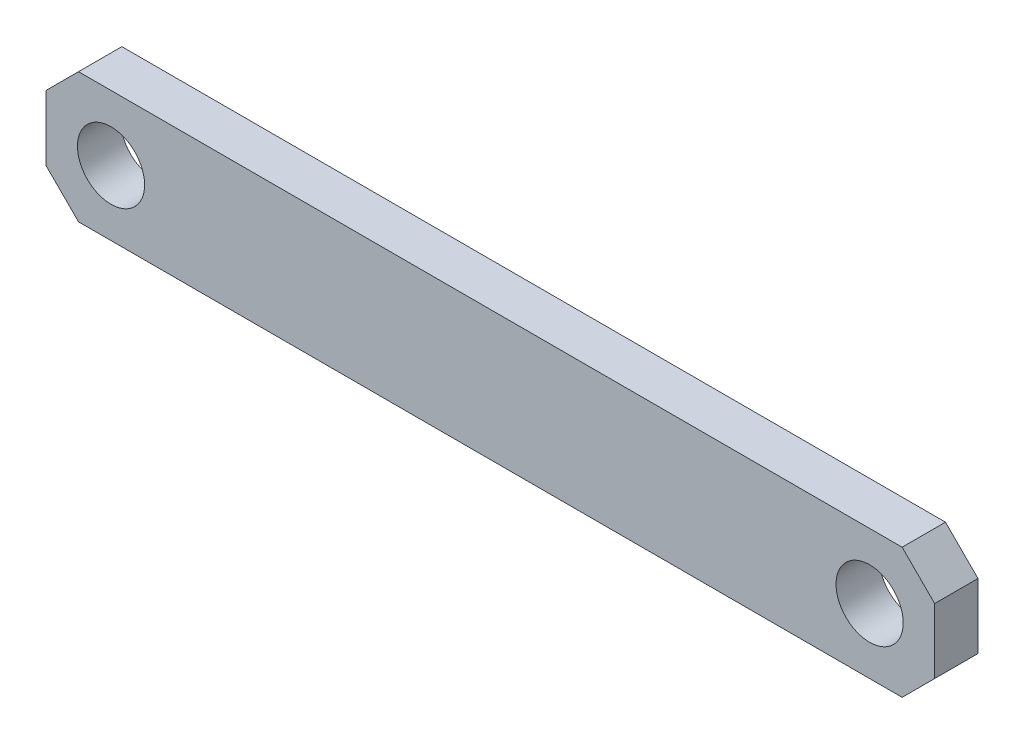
SolidWorks part; units mm, degrees
ref_plane "前视基准面" through (0, 0, 0) normal (0, 0, 1) x (1, 0, 0)
ref_plane "上视基准面" through (0, 0, 0) normal (0, 1, 0) x (1, 0, 0)
ref_plane "右视基准面" through (0, 0, 0) normal (1, 0, 0) x (0, 0, -1)
other "Configuration Table"
sketch "草图1" plane through (0, 0, 0) normal (0, 0, 1) x (1, 0, 0)
  line L0 (-6, -3) -> (-3, -6)
  line L1 (-3, -6) -> (73, -6)
  line L2 (73, -6) -> (76, -3)
  line L3 (76, -3) -> (76, 3)
  line L4 (76, 3) -> (73, 6)
  line L5 (73, 6) -> (-3, 6)
  line L6 (-3, 6) -> (-6, 3)
  line L7 (-6, 3) -> (-6, -3)
  dimension "D1" = 73
  dimension "D2" = 76
  dimension "D3" = 3
  dimension "D4" = 3
  dimension "D5" = 6
  dimension "D6" = 3
extrude "Link_Pitch70" add sketch "草图1" against normal mid plane 4
sketch "草图2" plane through (0, 0, 0) normal (0, 0, 1) x (1, 0, 0)
  circle A0 centre (0, 0) radius 3.1
  circle A1 centre (70, 0) radius 3.1
  dimension "D1" = 6.2
  dimension "D2" = 70
extrude "Pivot_Bores_D6_2" cut sketch "草图2" against normal mid plane 500
